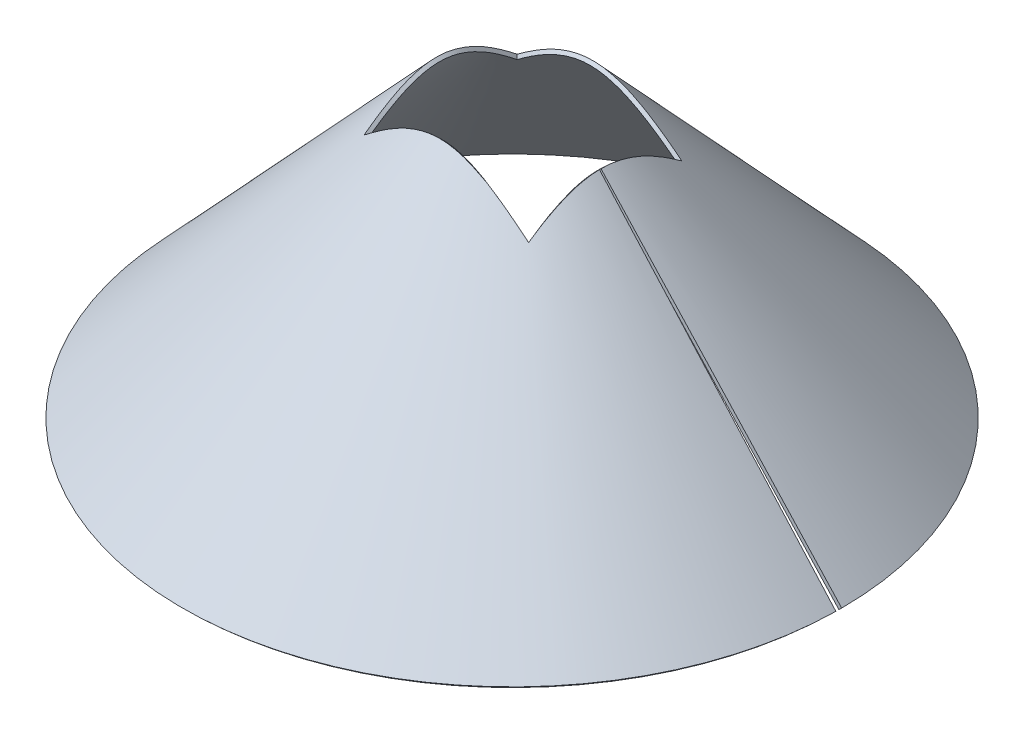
SolidWorks part; units mm, degrees
ref_plane "Ebene vorne" through (0, 0, 0) normal (0, 0, 1) x (1, 0, 0)
ref_plane "Ebene oben" through (0, 0, 0) normal (0, 1, 0) x (1, 0, 0)
ref_plane "Ebene rechts" through (0, 0, 0) normal (1, 0, 0) x (0, 0, -1)
sketch "Skizze1" plane through (0, 0, 0) normal (0, 0, 1) x (1, 0, 0)
  line L0 (0, 0) -> (0, 158.0187) construction
  line L1 (23.0615, 158.0187) -> (169.2546, 0)
revolve "Rotation-Dünn1" add sketch "Skizze1" angle 359 about L0
sketch "Skizze2" plane through (0, 0, 0) normal (0, 1, 0) x (1, 0, 0)
  line L1 (-38.8619, 41.5337) -> (45.6627, 41.5337)
  line L2 (-38.8619, 41.5337) -> (-38.8619, -37.1617)
  line L3 (-38.8619, -37.1617) -> (45.6627, -37.1617)
  line L4 (45.6627, 41.5337) -> (45.6627, -37.1617)
extrude "Schnitt-Linear austragen1" cut sketch "Skizze2" along normal through all
sheet metal parameters "Blech1" parameters "D1"=0.3, "Dicke"=2
bend "Biegung-Rundung1" bend radius 21.5934 bend angle 359 parameters "D5"=1
flatten bends "Abwickeln1" parameters "D1"=0
sketch "Skizze-Winkel1" plane through (107.4587, 66.7946, 0) normal (0.734, 0.6791, 0) x (0, 0, -1)
  line L0 (58.9199, 194.9092) -> (211.5912, 289.9373) construction
process bends "Abbiegen1" parameters "D1"=0
sketch "Abwicklung-Skizze1" plane through (91.1968, 84.3719, 0) normal (0.734, 0.6791, 0) x (0, 0, -1)
equation "\"LÄNGE\"=0"
equation "\"BREITE\"=0"
equation "\"HÖHE\"=0"
equation "\"DURCHMESSER\"=0"
equation "\"Stückzahl\"= 1"
